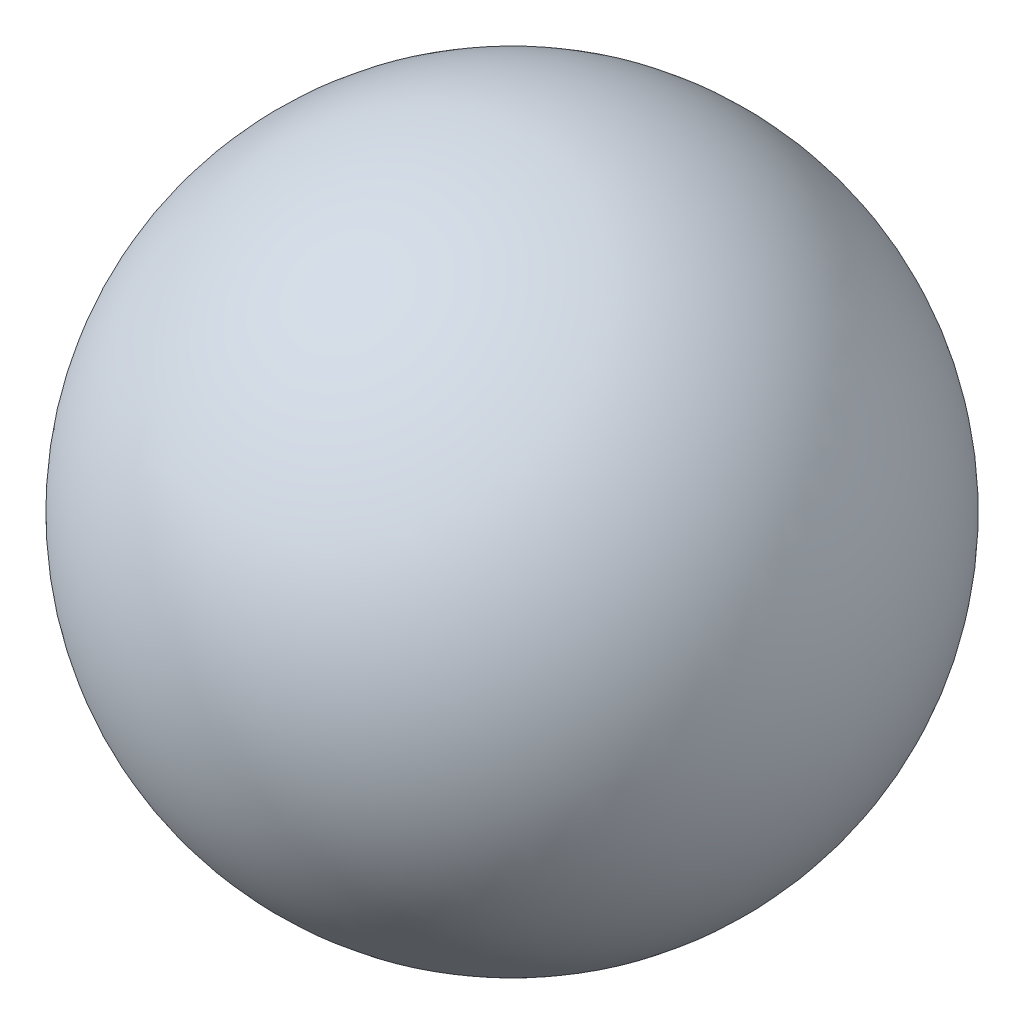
SolidWorks part; units mm, degrees
ref_plane "Plan de face" through (0, 0, 0) normal (0, 0, 1) x (1, 0, 0)
ref_plane "Plan de dessus" through (0, 0, 0) normal (0, 1, 0) x (1, 0, 0)
ref_plane "Plan de droite" through (0, 0, 0) normal (1, 0, 0) x (0, 0, -1)
sketch "Esquisse1" plane through (0, 0, 0) normal (0, 0, 1) x (1, 0, 0)
  line L0 (-61.5, 16.0133) -> (-61.5, -2.0428) construction
  line L1 (-61.5, 16.5216) -> (-61.5, -2.2568) construction
  line L2 (-61.5, 1.8812) -> (-57.5, 4.1906) construction
  line L3 (-61.5, 10.5) -> (-61.5, 2.5)
  arc A0 (-61.5, 2.5) -> (-61.5, 10.5) centre (-61.5, 6.5) ccw
  dimension "D1" = 4
revolve "Révolution1" add sketch "Esquisse1" angle 360 about L0
